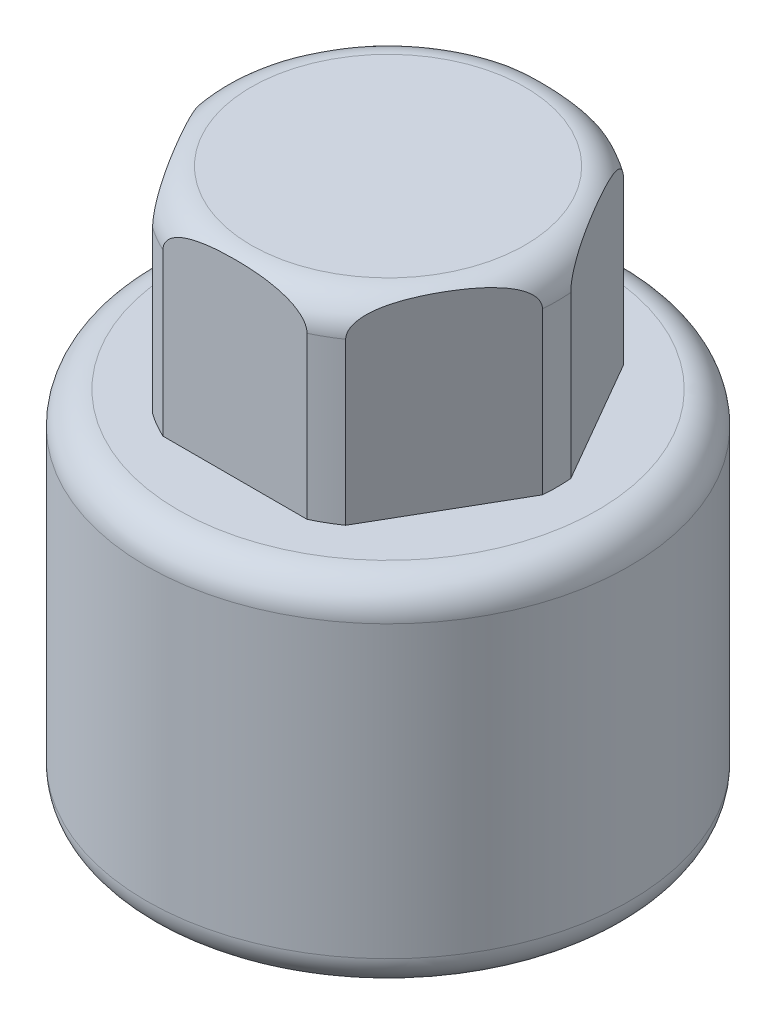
SolidWorks part; units mm, degrees
ref_plane "Front Plane" through (0, 0, 0) normal (0, 0, 1) x (1, 0, 0)
ref_plane "Top Plane" through (0, 0, 0) normal (0, 1, 0) x (1, 0, 0)
ref_plane "Right Plane" through (0, 0, 0) normal (1, 0, 0) x (0, 0, -1)
sketch "Sketch1" plane through (0, 0, 0) normal (0, 0, 1) x (1, 0, 0)
  line L0 (0, 17.2) -> (0, -16.1) construction
  line L1 (-15, 20) -> (-15, 2)
  line L2 (-13, 0) -> (-10.5, 0)
  line L3 (-10.5, 0) -> (0, 10.5)
  line L4 (0, 10.5) -> (0, 34)
  line L5 (0, 34) -> (-8.5, 34)
  line L6 (-10.5, 32) -> (-10.5, 22)
  line L7 (-10.5, 22) -> (-13, 22)
  arc A0 (-15, 2) -> (-13, 0) centre (-13, 2) ccw
  arc A1 (-15, 20) -> (-13, 22) centre (-13, 20) cw
  arc A2 (-8.5, 34) -> (-10.5, 32) centre (-8.5, 32) ccw
  point P16 (-10.5, 34)
  dimension "D7" = 2
  dimension "D1" = 30
  dimension "D2" = 21
  dimension "D3" = 45
  dimension "D4" = 22
  dimension "D5" = 21
  dimension "D6" = 12
revolve "Revolve1" add sketch "Sketch1" angle 360 about L0
sketch "Sketch2" plane through (0, 0, 0) normal (0, -1, 0) x (1, 0, 0)
  line L1 (-11.1429, 0) -> (-5.5714, -9.65)
  line L2 (-5.5714, -9.65) -> (5.5714, -9.65)
  line L3 (5.5714, -9.65) -> (11.1429, 0)
  line L4 (11.1429, 0) -> (5.5714, 9.65)
  line L5 (5.5714, 9.65) -> (-5.5714, 9.65)
  line L6 (-5.5714, 9.65) -> (-11.1429, 0)
  circle A0 centre (0, 0) radius 9.65 construction
  circle A1 centre (0, 0) radius 10.5
  dimension "D2" = 21
  dimension "D1" = 19.3
extrude "Cut-Extrude1" cut sketch "Sketch2" against normal blind 12 contours L6 L1 L2 L3 L4 L5 M3
sketch "Sketch3" plane through (0, 34, 0) normal (0, 1, 0) x (1, 0, 0)
  line L1 (-10.9697, 0) -> (-5.4848, -9.5)
  line L2 (-5.4848, -9.5) -> (5.4848, -9.5)
  line L3 (5.4848, -9.5) -> (10.9697, 0)
  line L4 (10.9697, 0) -> (5.4848, 9.5)
  line L5 (5.4848, 9.5) -> (-5.4848, 9.5)
  line L6 (-5.4848, 9.5) -> (-10.9697, 0)
  circle A0 centre (0, 0) radius 9.5 construction
  circle A1 centre (0, 0) radius 15.597
  dimension "D1" = 19
extrude "Cut-Extrude2" cut sketch "Sketch3" against normal up to surface (12 mm away)
sketch "Sketch4" plane through (0, 0, 0) normal (0, -1, 0) x (1, 0, 0)
  circle A0 centre (0, 0) radius 7
  dimension "D1" = 14
extrude "Cut-Extrude3" cut sketch "Sketch4" against normal blind 19
fillet "Fillet1" radius 2 1 edges at (0, 12, -7)
